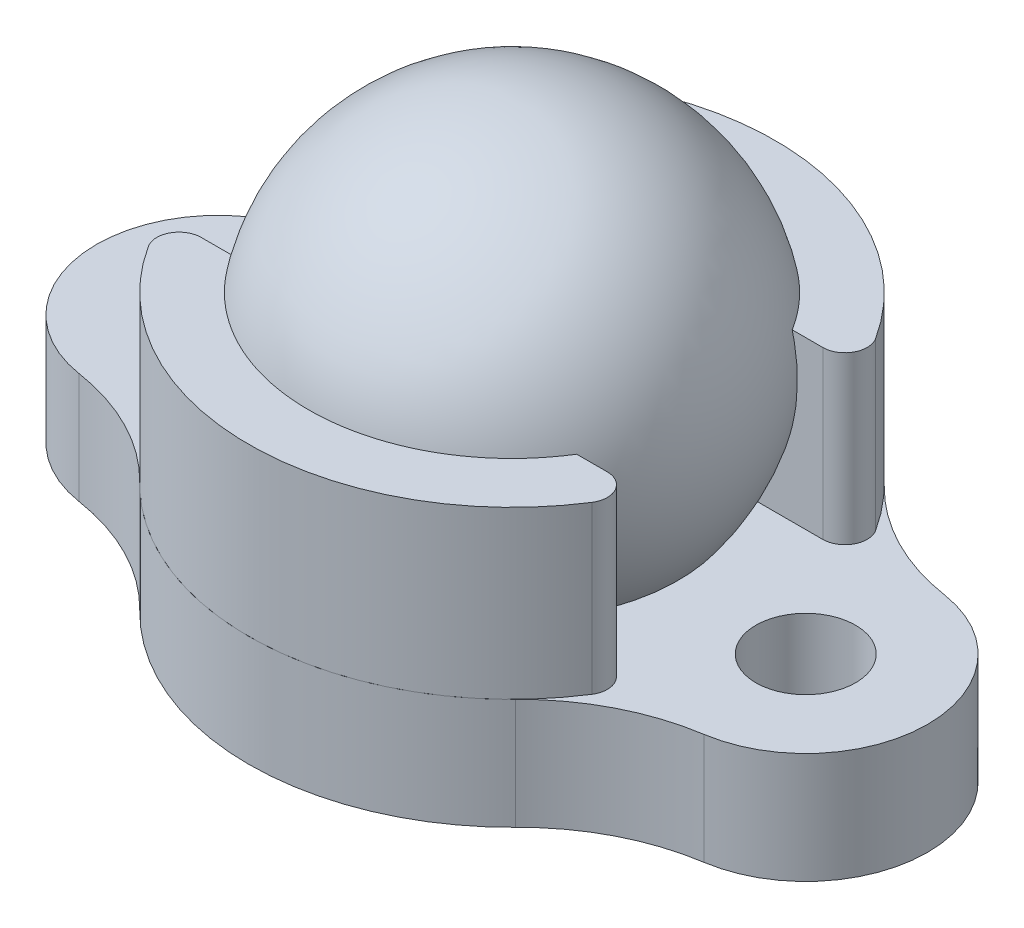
SolidWorks part; units mm, degrees
ref_plane "Front Plane" through (0, 0, 0) normal (0, 0, 1) x (1, 0, 0)
ref_plane "Top Plane" through (0, 0, 0) normal (0, 1, 0) x (1, 0, 0)
ref_plane "Right Plane" through (0, 0, 0) normal (1, 0, 0) x (0, 0, -1)
sketch "Sketch1" plane through (0, 0, 0) normal (0, 1, 0) x (1, 0, 0)
  line L0 (-6.731, 0) -> (6.731, 0) construction
  line L1 (-652.8997, -241.9076) -> (-119.5664, -241.9076) construction
  circle A0 centre (-6.731, 0) radius 1.143
  circle A1 centre (6.731, 0) radius 1.143
  arc A2 (-7.1575, 2.7613) -> (-7.1575, -2.7613) centre (-6.731, 0) ccw
  arc A3 (7.1575, -2.7613) -> (7.1575, 2.7613) centre (6.731, 0) ccw
  arc A4 (-4.3065, -4.2244) -> (4.3065, -4.2244) centre (0, 0) ccw
  arc A5 (4.3065, 4.2244) -> (-4.3065, 4.2244) centre (0, 0) ccw
  arc A6 (-7.1575, -2.7613) -> (-4.3065, -4.2244) centre (-7.933, -7.7817) cw
  arc A7 (4.3065, -4.2244) -> (7.1575, -2.7613) centre (7.933, -7.7817) cw
  arc A8 (7.1575, 2.7613) -> (4.3065, 4.2244) centre (7.933, 7.7817) cw
  arc A9 (-7.1575, 2.7613) -> (-4.3065, 4.2244) centre (-7.933, 7.7817) ccw
  point P7 (-9.525, 0)
  point P8 (9.525, 0)
  point P20 (5.4889, 2.5027)
  dimension "D2" = 2.286
  dimension "D4" = 12.065
  dimension "D5" = 5.08
  dimension "D1" = 13.462
  dimension "D3" = 19.05
extrude "Boss-Extrude1" add sketch "Sketch1" along normal blind 2.54
sketch "Sketch2" plane through (0, 0, 0) normal (0, 0, 1) x (1, 0, 0)
  line L0 (0, 5.3975) -> (0, 0) construction
  line L1 (-4.3065, 0) -> (4.3065, 0) construction
  line L2 (0, 10.16) -> (0, 0.635)
  arc A0 (0, 0.635) -> (0, 10.16) centre (0, 5.3975) ccw
  point P2 (0, 10.16)
  dimension "D1" = 9.525
  dimension "D2" = 10.16
revolve "Revolve2" add sketch "Sketch2" angle 360 about L0
sketch "Sketch3" plane through (0, 2.54, 0) normal (0, 1, 0) x (1, 0, 0)
  circle A0 centre (0, 0) radius 6.0325
  arc A1 (4.3065, 4.2244) -> (-4.3065, 4.2244) centre (0, 0) ccw construction
extrude "Boss-Extrude2" add sketch "Sketch3" along normal blind 3.81 separate body
sketch "Sketch4" plane through (0, 6.35, 0) normal (0, 1, 0) x (1, 0, 0)
  line L0 (-6.0325, 0) -> (6.0325, 0) construction
  line L1 (6.0325, -2.4692) -> (-6.0325, -2.4692)
  line L2 (6.0325, -2.4692) -> (6.0325, 2.4692)
  line L3 (6.0325, 2.4692) -> (-6.0325, 2.4692)
  line L4 (-6.0325, -2.4692) -> (-6.0325, 2.4692)
  circle A5 centre (0, 0) radius 6.0325 construction
extrude "Cut-Extrude1" cut sketch "Sketch4" against normal up to surface (3.81 mm away)
fillet "Fillet3" radius 0.508 2 edges at (-5.504, 4.445, -2.4692) (5.504, 4.445, -2.4692)
fillet "Fillet4" radius 0.508 2 edges at (5.504, 4.445, 2.4692) (-5.504, 4.445, 2.4692)
